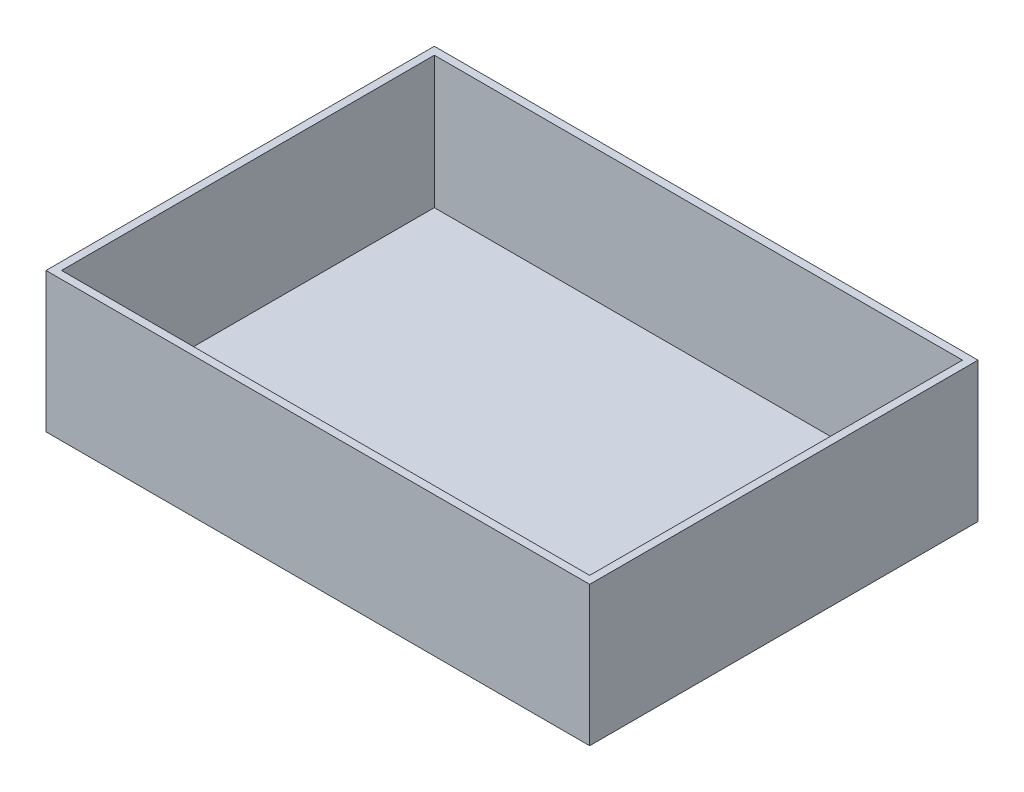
SolidWorks part; units mm, degrees
ref_plane "Alzado" through (0, 0, 0) normal (0, 0, 1) x (1, 0, 0)
ref_plane "Planta" through (0, 0, 0) normal (0, 1, 0) x (1, 0, 0)
ref_plane "Vista lateral" through (0, 0, 0) normal (1, 0, 0) x (0, 0, -1)
sketch "Croquis1" plane through (0, 0, 0) normal (0, 0, 1) x (1, 0, 0)
  line L1 (-364.2029, 234.3478) -> (335.7971, 234.3478)
  line L2 (-364.2029, 234.3478) -> (-364.2029, 54.3478)
  line L3 (-364.2029, 54.3478) -> (335.7971, 54.3478)
  line L4 (335.7971, 234.3478) -> (335.7971, 54.3478)
  dimension "D1" = 700
  dimension "D2" = 180
extrude "Saliente-Extruir1" add sketch "Croquis1" along normal blind 500
shell "Vaciado1" thickness 10
